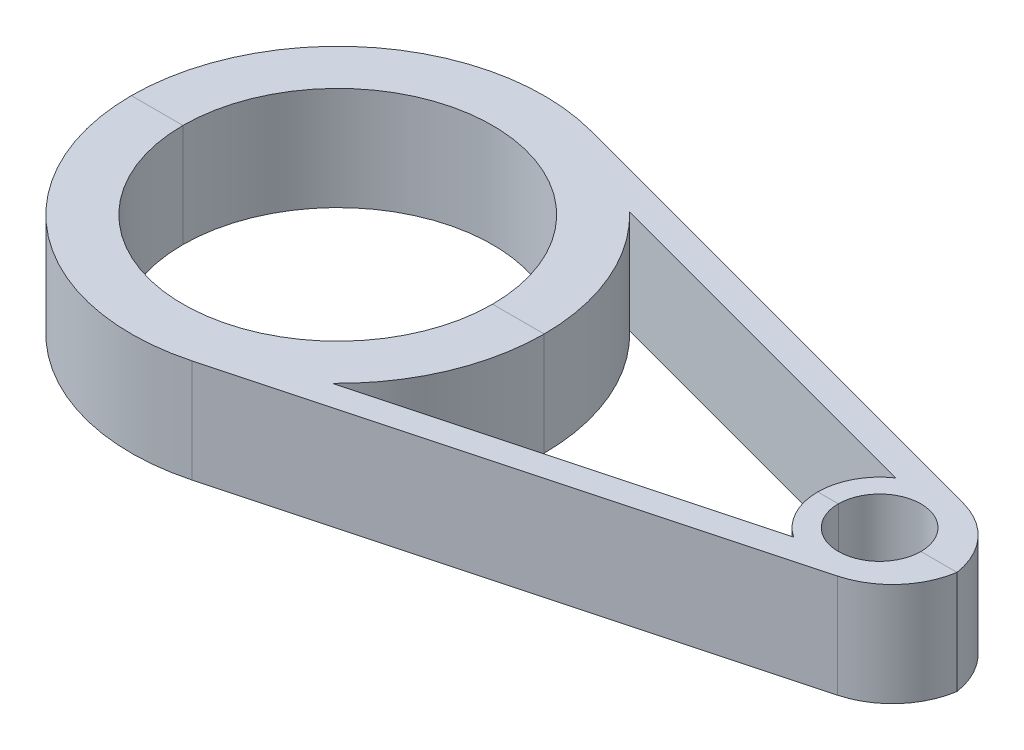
SolidWorks part; units mm, degrees
ref_plane "Front Plane" through (0, 0, 0) normal (0, 0, 1) x (1, 0, 0)
ref_plane "Top Plane" through (0, 0, 0) normal (0, 1, 0) x (1, 0, 0)
ref_plane "Right Plane" through (0, 0, 0) normal (1, 0, 0) x (0, 0, -1)
sketch "Sketch2" plane through (0, 0, 0) normal (0, 1, 0) x (1, 0, 0)
  line L0 (10.3528, 38.637) -> (109.0597, 12.1886)
  line L1 (120, 0) -> (113, 0)
  line L2 (-30, 0) -> (-40, 0)
  line L3 (97, 0) -> (30, 0)
  arc A0 (-40, 0) -> (10.3528, 38.637) centre (0, 0) cw
  arc A1 (109.0597, 12.1886) -> (120, 0) centre (105.1774, -2.3003) cw
  arc A2 (-30, 0) -> (30, 0) centre (0, 0) cw
  arc A3 (97, 0) -> (113, 0) centre (105, 0) cw
  dimension "D1" = 40
  dimension "D3" = 15
  dimension "D5" = 30
  dimension "D6" = 8
  dimension "D2" = 15
  dimension "D4" = 120
  dimension "D7" = 15
extrude "Extrude1" add sketch "Sketch2" along normal blind 20
sketch "Sketch3" plane through (0, 20, 0) normal (0, 1, 0) x (-1, 0, 0)
  line L1 (-30, 0) -> (-97, 0) construction
  line L2 (-107.7656, -7.359) -> (-9.0587, -33.8074)
  line L3 (-98.2364, -9.9123) -> (-27.7637, -28.7954)
  line L4 (-40, 0) -> (-93, 0)
  arc A2 (-117, 0) -> (-93, 0) centre (-105, 0) ccw
  arc A3 (-98.2364, -9.9123) -> (-93, 0) centre (-105, 0) ccw
  arc A5 (-40, 0) -> (40, 0) centre (0, 0) ccw
  arc A6 (-40, 0) -> (-27.7637, -28.7954) centre (0, 0) ccw
  dimension "D1" = 4
  dimension "D2" = 10
  dimension "D3" = 5
extrude "Cut-Extrude1" cut sketch "Sketch3" against normal through all
mirror "Mirror1" about plane through (97, 20, 0) normal (0, 0, -1)
